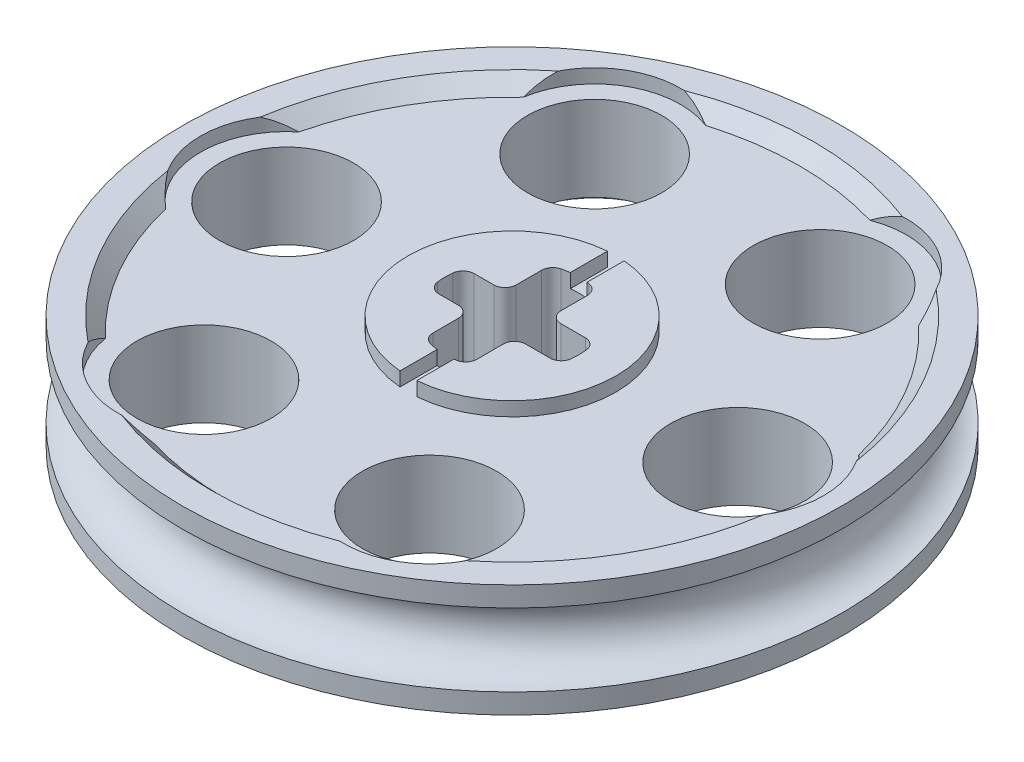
SolidWorks part; units mm, degrees
ref_plane "정면" through (0, 0, 0) normal (0, 0, 1) x (1, 0, 0)
ref_plane "윗면" through (0, 0, 0) normal (0, 1, 0) x (1, 0, 0)
ref_plane "우측면" through (0, 0, 0) normal (1, 0, 0) x (0, 0, -1)
imported_body "불러온 피처3"
sketch "스케치2" plane through (0, 1.5163, 0) normal (0, 1, 0) x (-1, 0, 0)
  line L0 (0.3, -3.7079) -> (0.3, 3.7079)
  arc A0 (0.3, 3.7079) -> (0.3, -3.7079) centre (0, 0) cw
extrude "보스-돌출1" add sketch "스케치2" along normal blind 0.5
sketch "스케치3" plane through (0, -1.5163, 0) normal (0, -1, 0) x (1, 0, 0)
  line L0 (-0.3, 3.7079) -> (-0.3, -3.7079)
  arc A0 (-0.3, -3.7079) -> (-0.3, 3.7079) centre (0, 0) cw
extrude "보스-돌출2" add sketch "스케치3" along normal blind 0.5
sketch "스케치6" plane through (0, 1.5163, 0) normal (0, 1, 0) x (-1, 0, 0)
  line L0 (-0.3, 3.7079) -> (-0.3, -3.7079)
  arc A0 (-0.3, -3.7079) -> (-0.3, 3.7079) centre (0, 0) cw
extrude "보스-돌출3" add sketch "스케치6" along normal blind 0.5
sketch "스케치7" plane through (0, -1.5163, 0) normal (0, -1, 0) x (1, 0, 0)
  line L0 (0.3, -3.7079) -> (0.3, 3.7079)
  arc A0 (0.3, 3.7079) -> (0.3, -3.7079) centre (0, 0) cw
extrude "보스-돌출4" add sketch "스케치7" along normal blind 0.5
hole_wizard "M4 여유 구멍1" positions "스케치12" profile "스케치11" hole size "M4" standard "Ansi Metric"
sketch "스케치12" plane through (0, 1.5163, 0) normal (0, 1, 0) x (1, 0, 0)
  point P0 (8.065, 0)
  point P1 (4.0325, 6.9845)
  point P2 (-4.0325, 6.9845)
  point P3 (-8.065, 0)
  point P4 (-4.0325, -6.9845)
  point P5 (4.0325, -6.9845)
sketch "스케치11" plane through (8.065, 1.5163, 0) normal (1, 0, 0) x (0, 0, 1)
  line L0 (0, 0) -> (0, 3.5325)
  line L1 (0, 3.5325) -> (2.4, 3.5325)
  line L2 (2.4, 3.5325) -> (2.4, 0)
  line L5 (2.4, 0) -> (0, 0)
  line L11 (0, -6.35) -> (0, 107.95) construction
  dimension "관통 구멍 지름" = 4.8
  dimension "관통 구멍 깊이" = 3.5325
sketch "스케치13" plane through (0, 0, 0) normal (0, 1, 0) x (1, 0, 0)
  line L0 (0.7155, 0.6311) -> (2.3155, 0.6311)
  line L1 (0.7155, -0.6311) -> (2.3155, -0.6311)
  line L2 (-0.8845, -2.2311) -> (-0.8845, -0.6311)
  line L3 (-0.8845, 0.6311) -> (-0.8845, 2.2311)
  line L4 (0.7155, -2.2909) -> (0.7155, -0.6311)
  line L5 (-2.3155, -0.6311) -> (-0.8845, -0.6311)
  line L6 (0.7155, 0.6311) -> (0.7155, 2.2909)
  line L7 (-2.3155, 0.6311) -> (-0.8845, 0.6311)
  arc A0 (-2.3155, 0.6311) -> (-2.3155, -0.6311) centre (0, 0) ccw
  arc A1 (0.7155, 2.2909) -> (-0.8845, 2.2311) centre (0, 0) ccw
  arc A2 (2.3155, -0.6311) -> (2.3155, 0.6311) centre (0, 0) ccw
  arc A3 (-0.8845, -2.2311) -> (0.7155, -2.2909) centre (0, 0) ccw
extrude "컷-돌출7" cut sketch "스케치13" against normal through all both and the other way through all
fillet "필렛4" radius 0.4 12 edges at (2.3155, 0, -0.6311) (2.3155, 0, 0.6311) (0.7155, 0, 0.6311) (0.7155, 0, 2.2909) (-0.8845, 0, 2.2311) (-0.8845, 0, 0.6311) (-2.3155, 0, 0.6311) (-2.3155, 0, -0.6311) (-0.8845, 0, -0.6311) (-0.8845, 0, -2.2311) (0.7155, 0, -2.2909) (0.7155, 0, -0.6311)
